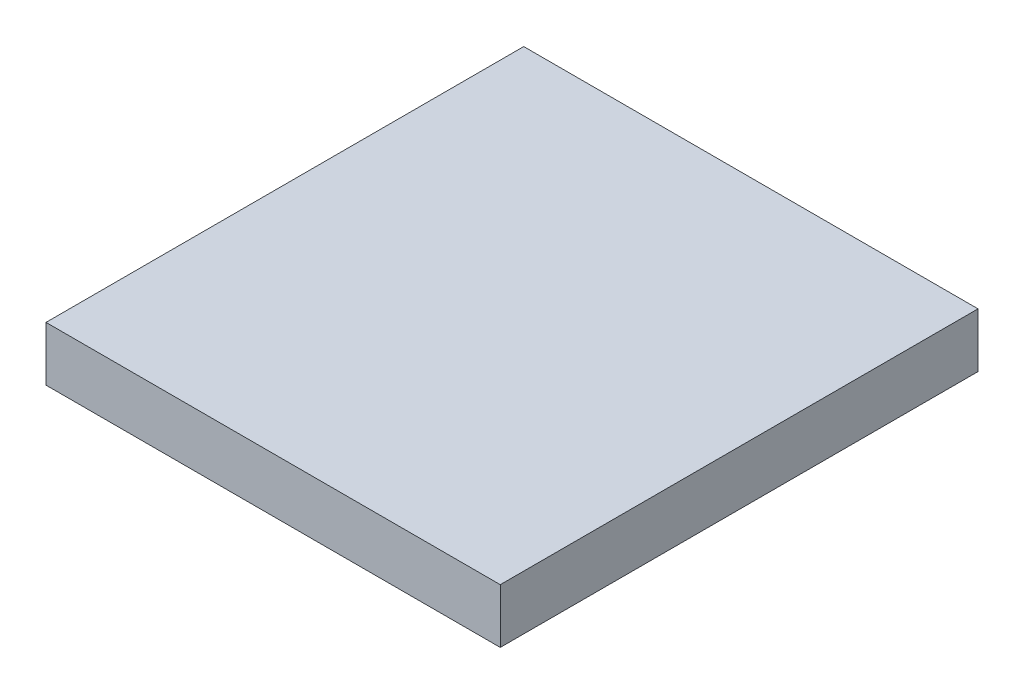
SolidWorks part; units mm, degrees
ref_plane "Ebene vorne" through (0, 0, 0) normal (0, 0, 1) x (1, 0, 0)
ref_plane "Ebene oben" through (0, 0, 0) normal (0, 1, 0) x (1, 0, 0)
ref_plane "Ebene rechts" through (0, 0, 0) normal (1, 0, 0) x (0, 0, -1)
sketch "Skizze1" plane through (0, 0, 0) normal (0, 1, 0) x (1, 0, 0)
  line L1 (0, 0) -> (100.2579, 0)
  line L2 (0, 0) -> (0, 105.436)
  line L3 (0, 105.436) -> (100.2579, 105.436)
  line L4 (100.2579, 0) -> (100.2579, 105.436)
extrude "Linear austragen1" add sketch "Skizze1" along normal blind 12
